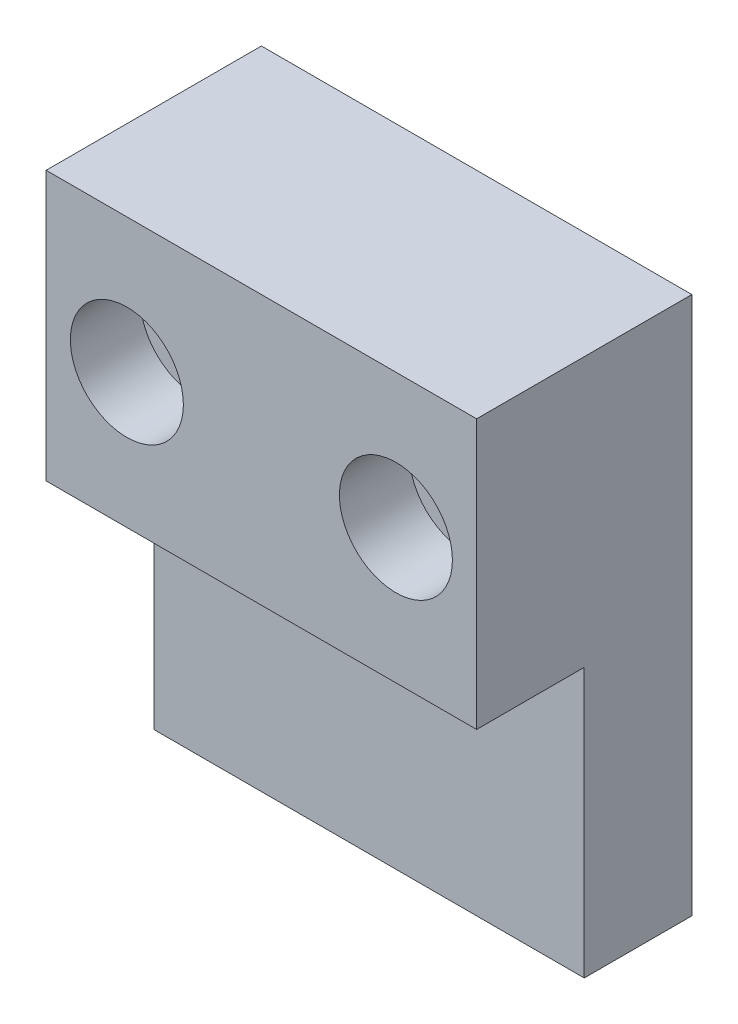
SolidWorks part; units mm, degrees
ref_plane "Plan de face" through (0, 0, 0) normal (0, 0, 1) x (1, 0, 0)
ref_plane "Plan de dessus" through (0, 0, 0) normal (0, 1, 0) x (1, 0, 0)
ref_plane "Plan de droite" through (0, 0, 0) normal (1, 0, 0) x (0, 0, -1)
sketch "Esquisse1" plane through (0, 0, 0) normal (0, 0, 1) x (1, 0, 0)
  line L1 (0, 0) -> (40, 0)
  line L2 (0, 0) -> (0, 50)
  line L3 (0, 50) -> (40, 50)
  line L4 (40, 0) -> (40, 50)
  dimension "D1" = 40
  dimension "D2" = 50
extrude "Extrusion1" add sketch "Esquisse1" along normal blind 20
sketch "Esquisse3" plane through (0, 0, 20) normal (0, 0, 1) x (1, 0, 0)
  line L0 (40, 0) -> (40, 50) construction
  line L1 (0, 0) -> (40, 0)
  line L2 (0, 0) -> (0, 25)
  line L3 (0, 25) -> (40, 25)
  line L4 (40, 0) -> (40, 25)
  dimension "D1" = 25
extrude "Enlèv. mat.-Extru.1" cut sketch "Esquisse3" against normal blind 10
hole_wizard "Perçage1" positions "Esquisse5" profile "Esquisse4" legacy
sketch "Esquisse5" plane through (0, 0, 20) normal (0, 0, 1) x (1, 0, 0)
  line L0 (40, 50) -> (0, 50) construction
  line L1 (0, 50) -> (0, 25) construction
  point P0 (7.5, 37.5)
  point P6 (32.5, 37.5)
  dimension "D1" = 12.5
  dimension "D2" = 7.5
  dimension "D3" = 25
sketch "Esquisse4" plane through (7.5, 37.5, 20) normal (1, 0, 0) x (0, -1, 0)
  line L0 (0, 0) -> (0, 26.9528)
  line L1 (0, 26.9528) -> (3.25, 25)
  line L2 (3.25, 25) -> (3.25, 6.5)
  line L3 (3.25, 6.5) -> (5.25, 6.5)
  line L4 (5.25, 0) -> (0, 0)
  line L5 (0, -11.3109) -> (0, 121.1557) construction
  line L6 (0, 26.9528) -> (-3.25, 25) construction
  line L7 (5.25, 6.5) -> (5.25, 0)
  dimension "Diamètre" = 6.5
  dimension "Profondeur" = 25
  dimension "Diamètre chambrage" = 10.5
  dimension "Profondeur chambrage" = 6.5
  dimension "Angle" = 118
sketch "Esquisse7" plane through (0, 0, 0) normal (0, 0, -1) x (-1, 0, 0)
  circle A0 centre (-32.5, 37.5) radius 6
  dimension "D1" = 12
extrude "Enlèv. mat.-Extru.2" cut sketch "Esquisse7" against normal blind 5
sketch "Esquisse8" plane through (0, 0, 0) normal (0, 0, -1) x (-1, 0, 0)
  circle A0 centre (-7.5, 37.5) radius 6
  dimension "D1" = 12
extrude "Enlèv. mat.-Extru.3" cut sketch "Esquisse8" against normal blind 5
